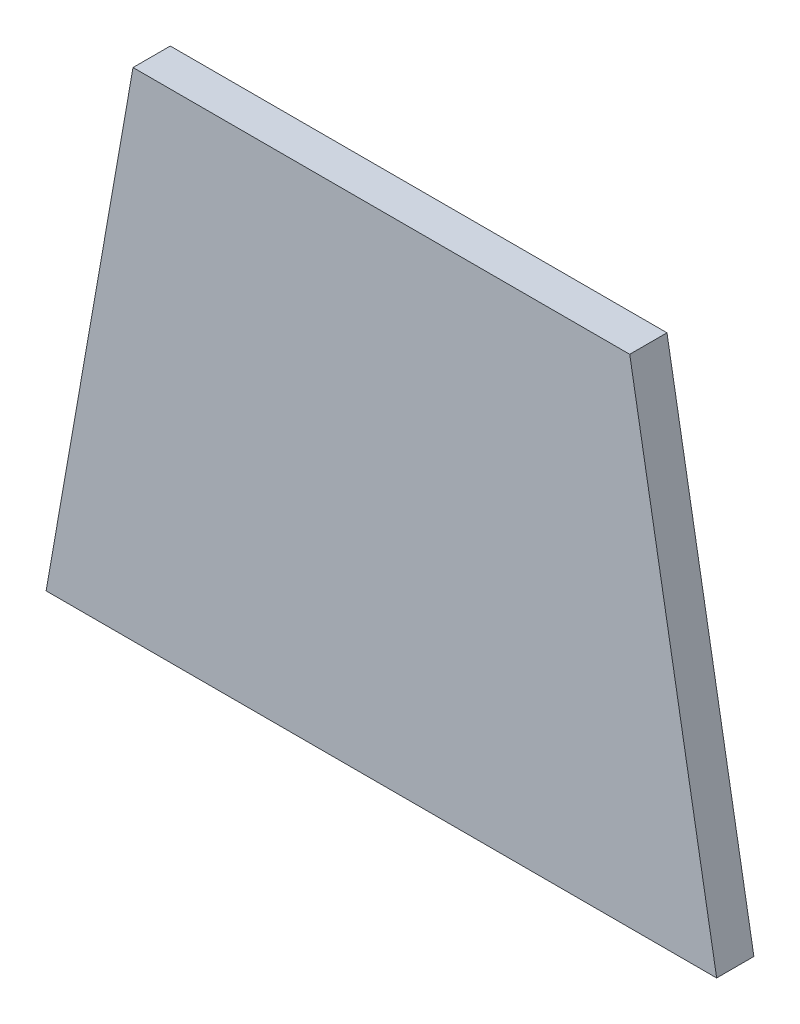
SolidWorks part; units mm, degrees
ref_plane "Plan de face" through (0, 0, 0) normal (0, 0, 1) x (1, 0, 0)
ref_plane "Plan de dessus" through (0, 0, 0) normal (0, 1, 0) x (1, 0, 0)
ref_plane "Plan de droite" through (0, 0, 0) normal (1, 0, 0) x (0, 0, -1)
sketch "Esquisse1" plane through (0, 0, 0) normal (0, 0, 1) x (1, 0, 0)
  line L0 (-135, 0) -> (135, 0)
  line L1 (135, 0) -> (100, 200)
  line L2 (100, 200) -> (-100, 200)
  line L3 (-100, 200) -> (-135, 0)
  dimension "D1" = 135
  dimension "D2" = 135
  dimension "D3" = 100
  dimension "D4" = 100
  dimension "D5" = 200
extrude "Boss.-Extru.1" add sketch "Esquisse1" along normal blind 15
